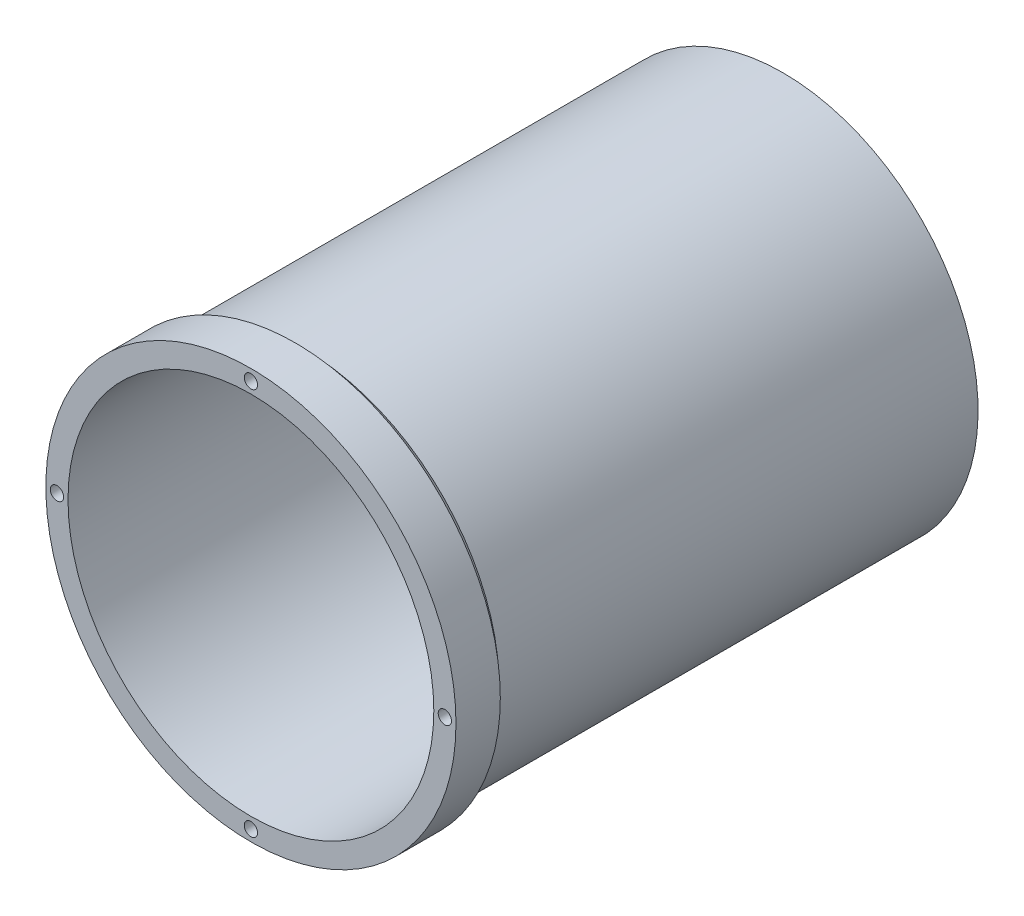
SolidWorks part; units mm, degrees
ref_plane "Front Plane" through (0, 0, 0) normal (0, 0, 1) x (1, 0, 0)
ref_plane "Top Plane" through (0, 0, 0) normal (0, 1, 0) x (1, 0, 0)
ref_plane "Right Plane" through (0, 0, 0) normal (1, 0, 0) x (0, 0, -1)
sketch "Sketch1" plane through (0, 0, 0) normal (0, 0, 1) x (1, 0, 0)
  circle A0 centre (0, 0) radius 55.88
  dimension "D1" = 111.76
extrude "Boss-Extrude1" add sketch "Sketch1" against normal blind 152.4
sketch "Sketch2" plane through (0, 0, 0) normal (0, 0, 1) x (1, 0, 0)
  circle A0 centre (0, 0) radius 52.3875
  dimension "D1" = 104.775
extrude "Cut-Extrude1" cut sketch "Sketch2" against normal blind 139.7
sketch "Sketch3" plane through (0, 0, 0) normal (0, 0, 1) x (1, 0, 0)
  line L0 (-1.5748, -55.8578) -> (1.5748, -55.8578)
  circle A0 centre (0, 0) radius 55.88 construction
  dimension "D1" = 1.5748
  dimension "D2" = 1.5748
extrude "Cut-Extrude2" cut sketch "Sketch3" along normal through all and the other way through all flip side to cut
sketch "Sketch4" plane through (0, 0, 0) normal (0, 0, 1) x (1, 0, 0)
  circle A0 centre (0, 0) radius 58.7375
  circle A1 centre (0, 0) radius 52.3875
  circle A2 centre (0, 0) radius 52.3875 construction
  dimension "D1" = 117.475
extrude "Boss-Extrude2" add sketch "Sketch4" against normal blind 12.7
sketch "Sketch5" plane through (0, 0, 0) normal (0, 0, 1) x (1, 0, 0)
  circle A0 centre (0, 55.5498) radius 1.905
  dimension "D1" = 3.81
  dimension "D2" = 55.5498
extrude "Cut-Extrude3" cut sketch "Sketch5" against normal blind 7.9248
pattern_circular "CirPattern1" count 4 over 360 about axis through (0, 0, 0) along (0, 0, 1) of "Cut-Extrude3"
chamfer "Chamfer1" distance 2.54 angle 45 1 edges at (0, 55.88, -12.7)
sketch "Sketch6" plane through (0, 0, -152.4) normal (0, 0, -1) x (-1, 0, 0)
  circle A0 centre (0, 0) radius 2.667
  dimension "D1" = 5.334
extrude "Cut-Extrude4" cut sketch "Sketch6" against normal blind 9.525
